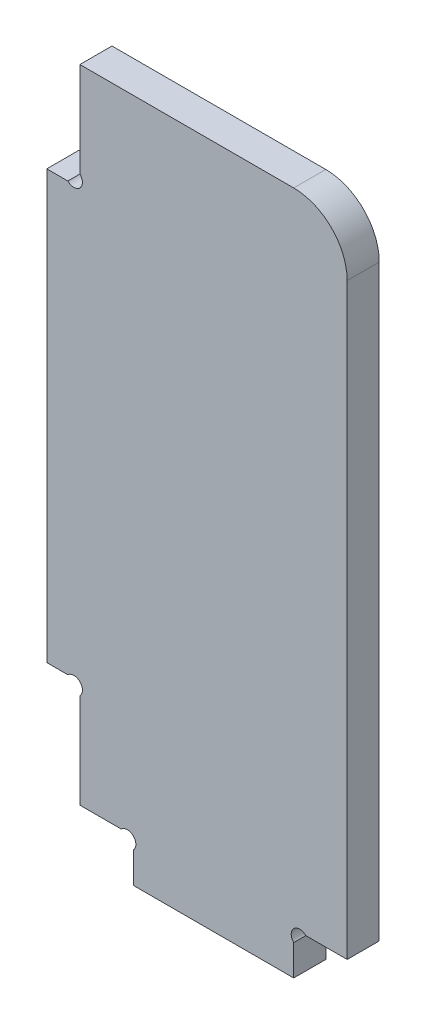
SolidWorks part; units mm, degrees
ref_plane "Face" through (0, 0, 0) normal (0, 0, 1) x (1, 0, 0)
ref_plane "Dessus" through (0, 0, 0) normal (0, 1, 0) x (1, 0, 0)
ref_plane "Droite" through (0, 0, 0) normal (1, 0, 0) x (0, 0, -1)
sketch "Esquisse1" plane through (0, 0, 0) normal (0, 0, 1) x (1, 0, 0)
  line L0 (-18.4069, 0) -> (62.0707, 0) construction
  line L1 (46.2, -4.3669) -> (46.2, 134.3669) construction
  line L2 (51.2, 82.9716) -> (51.2, 65) construction
  line L3 (6.2, 130) -> (46.2, 130)
  line L4 (58.7688, 2) -> (12.0501, 2) construction
  line L5 (0, -17.147) -> (0, 141.7933) construction
  line L6 (-18.4069, 10) -> (62.0707, 10) construction
  line L7 (-11.2607, 30) -> (62.0707, 30) construction
  line L8 (-18.4069, 70) -> (62.0707, 70) construction
  line L9 (6.2, -17.147) -> (6.2, 143.5106) construction
  line L10 (16.2, -17.147) -> (16.2, 14.5819) construction
  line L11 (31.2, -17.147) -> (31.2, 14.5819) construction
  line L12 (6.2, 30) -> (-2.9918, 20.8082) construction
  line L13 (16.2, 7.7373) -> (16.2, 2)
  line L14 (16.2, 10) -> (5.0264, -1.1736) construction
  line L15 (13.9373, 10) -> (6.2, 10)
  line L16 (6.2, 27.7373) -> (6.2, 10)
  line L17 (3.9373, 30) -> (0, 30)
  line L18 (46.2, 7.7373) -> (46.2, 2)
  line L19 (48.4627, 10) -> (56.2, 10)
  line L20 (6.2, 112.2627) -> (6.2, 130)
  line L21 (3.9373, 110) -> (0, 110)
  line L22 (0, 30) -> (0, 110)
  line L23 (-29.9983, 130) -> (110.0892, 130) construction
  line L24 (16.2, 2) -> (46.2, 2)
  line L25 (56.2, 5.5138) -> (56.2, 139.7039) construction
  line L26 (56.2, 120) -> (56.2, 10)
  arc A0 (16.2, 7.7373) -> (13.9373, 10) centre (15.0686, 8.8686) ccw
  arc A1 (6.2, 27.7373) -> (3.9373, 30) centre (5.0686, 28.8686) ccw
  arc A2 (46.2, 7.7373) -> (48.4627, 10) centre (47.3314, 8.8686) cw
  arc A3 (6.2, 112.2627) -> (3.9373, 110) centre (5.0686, 111.1314) cw
  arc A4 (46.2, 130) -> (56.2, 120) centre (46.2, 120) cw
  point P46 (56.2, 130)
  dimension "D9" = 5
  dimension "D10" = 10
  dimension "D1" = 10
  dimension "D2" = 20
  dimension "D3" = 60
  dimension "D4" = 6.2
  dimension "D5" = 10
  dimension "D6" = 15
  dimension "D7" = 45
  dimension "D8" = 45
  dimension "D11" = 8
extrude "Extrusion1" add sketch "Esquisse1" along normal blind 6
